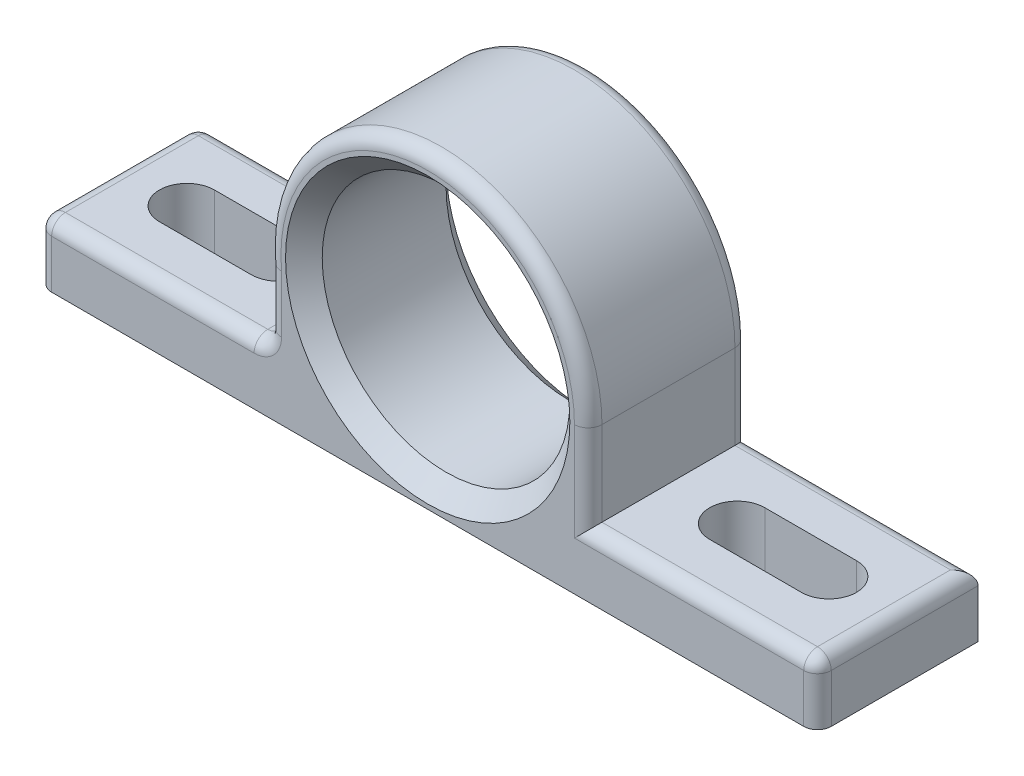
SolidWorks part; units mm, degrees
ref_plane "Face" through (0, 0, 0) normal (0, 0, 1) x (1, 0, 0)
ref_plane "Dessus" through (0, 0, 0) normal (0, 1, 0) x (1, 0, 0)
ref_plane "Droite" through (0, 0, 0) normal (1, 0, 0) x (0, 0, -1)
sketch "Esquisse1" plane through (0, 0, 0) normal (0, 0, 1) x (1, 0, 0)
  line L0 (35, 0) -> (35, -18.4341)
  line L1 (35, -18.4341) -> (85, -18.4341)
  line L2 (85, -18.4341) -> (85, -32)
  line L3 (85, -32) -> (-85, -32)
  line L4 (-85, -32) -> (-85, -18.4341)
  line L5 (-85, -18.4341) -> (-34.8645, -18.4341)
  line L6 (-34.8645, -3.0763) -> (-34.8645, -18.4341)
  circle A0 centre (0, 0) radius 27
  arc A1 (35, 0) -> (-34.8645, -3.0763) centre (0, 0) ccw
  dimension "D1" = 54
  dimension "D3" = 35
  dimension "D2" = 32
  dimension "D4" = 170
  dimension "D5" = 85
extrude "Extrusion1" add sketch "Esquisse1" along normal mid plane 35
sketch "Esquisse2" plane through (0, -32, 0) normal (0, -1, 0) x (1, 0, 0)
  line L0 (-70, 6) -> (-50, 6)
  line L1 (-70, -6) -> (-50, -6)
  line L2 (50, 6) -> (70, 6)
  line L3 (50, -6) -> (70, -6)
  arc A0 (-70, 6) -> (-70, -6) centre (-70, 0) ccw
  arc A1 (-50, -6) -> (-50, 6) centre (-50, 0) ccw
  arc A2 (50, 6) -> (50, -6) centre (50, 0) ccw
  arc A3 (70, -6) -> (70, 6) centre (70, 0) ccw
  dimension "D2" = 12
  dimension "D3" = 20
  dimension "D1" = 120
  dimension "D4" = 20
  dimension "D5" = 70
extrude "Enlèv. mat.-Extru.1" cut sketch "Esquisse2" against normal blind 40
fillet "Congé4" radius 3
chamfer "Chanfrein1" distance 4 angle 45
